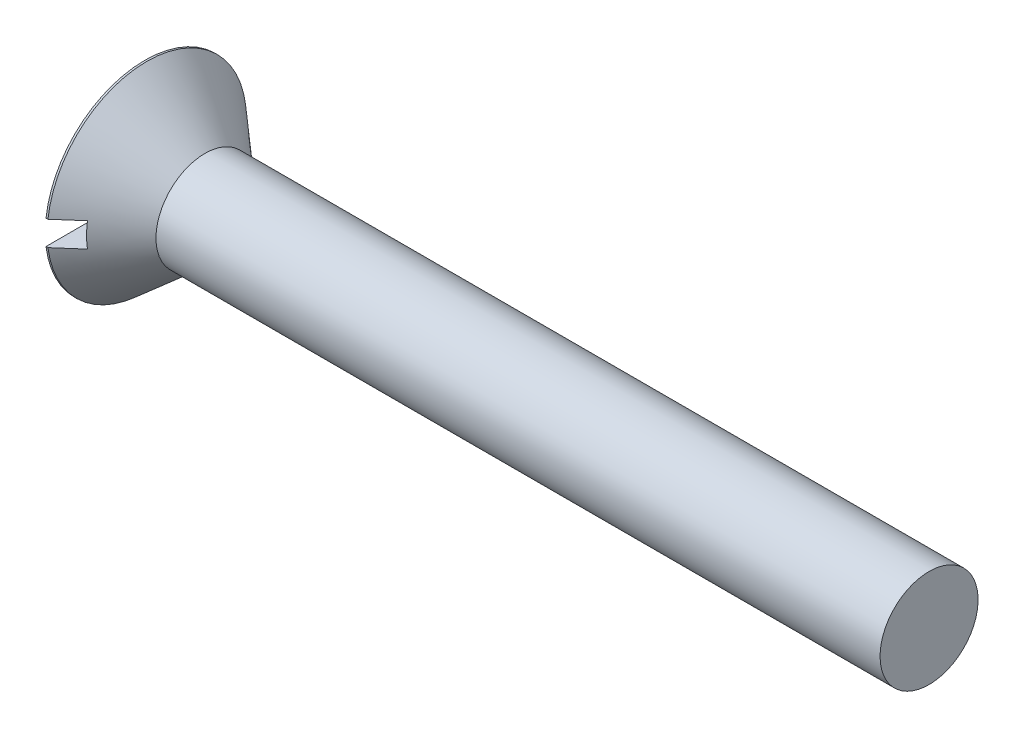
SolidWorks part; units mm, degrees
ref_plane "Plane1" through (0, 0, 0) normal (0, 0, 1) x (1, 0, 0)
ref_plane "Plane2" through (0, 0, 0) normal (0, 1, 0) x (1, 0, 0)
ref_plane "Plane3" through (0, 0, 0) normal (1, 0, 0) x (0, 0, -1)
sketch "BodySke" plane through (0, 0, 0) normal (0, 0, 1) x (1, 0, 0)
  line L0 (0, 0) -> (0, 9.6774)
  line L1 (0, 9.6774) -> (0.1881, 9.6774)
  line L2 (5.842, 4.7625) -> (76.2, 4.7625)
  line L3 (76.2, 4.7625) -> (76.2, 0)
  line L4 (76.2, 0) -> (0, 0)
  line L5 (-6.35, 0) -> (82.55, 0) construction
  line L6 (5.842, -4.7625) -> (76.2, -4.7625) construction
  line L7 (0.1881, -9.6774) -> (5.842, -4.7625) construction
  line L8 (0.1881, 9.6774) -> (5.842, 4.7625)
  line L9 (0, -9.6774) -> (0.1881, -9.6774) construction
  line L10 (7.4295, 6.35) -> (7.4295, -3.175) construction
  line L11 (44.45, 6.35) -> (44.45, -3.175) construction
  dimension "Diameter" = 9.525
  dimension "Length" = 76.2
  dimension "Head_ht" = 5.842
  dimension "Head_dia" = 19.3548
  dimension "Head_ang" = 82
  dimension "D6" = 0.1881
  dimension "Advance" = 1.5875
  dimension "Thread_nom" = 31.75
revolve "Base-Revolve" add sketch "BodySke" angle 360 about L5
sketch "Sketch6" plane through (0, 0, 0) normal (-1, 0, 0) x (0, 0, 1)
  line L0 (-9.6774, -1.1938) -> (9.6774, -1.1938)
  line L1 (-9.6774, -1.1938) -> (-9.6774, 1.1938)
  line L2 (9.6774, 1.1938) -> (-9.6774, 1.1938)
  line L3 (9.6774, 1.1938) -> (9.6774, -1.1938)
  dimension "D1" = 1.1938
  dimension "Slot_width" = 2.3876
  dimension "D2" = 19.3548
  dimension "D3" = 9.6774
extrude "Slot" cut sketch "Sketch6" against normal blind 2.2352
sketch "ThdSchSke" plane through (0, 0, 0) normal (0, 0, 1) x (1, 0, 0)
  line L0 (44.45, -3.9624) -> (43.8898, -4.7625)
  line L1 (44.45, -3.9624) -> (45.0103, -4.7625)
  line L2 (45.0103, -4.7625) -> (45.0103, -5.9531)
  line L3 (-3.175, 0) -> (5.1513, 0) construction
  line L5 (45.0103, -5.9531) -> (43.8898, -5.9531)
  line L6 (43.8898, -5.9531) -> (43.8898, -4.7625)
  line L7 (0, 9.6774) -> (0, 1.1938) construction
  dimension "Thread_minor" = 7.9248
  dimension "Diameter" = 9.525
  dimension "Start" = 44.45
  dimension "SideAngle" = 55
  dimension "VeeAngle" = 70
  dimension "Overcut" = 11.9063
revolve "ThreadSchematic" [suppressed] cut sketch "ThdSchSke" angle 360 about L3
pattern_linear "ThdSchPat" [suppressed]
equation "\"D1@Sketch6\" = \"Slot_width@Sketch6\" / 2"
equation "\"D2@Sketch6\" = \"Head_dia@BodySke\""
equation "\"D3@Sketch6\" = \"D2@Sketch6\" / 2"
equation "\"Thread_length@ThreadCosmetic\" = ((sgn( (\"Length@BodySke\" - \"Advance@BodySke\" - \"Head_ht@BodySke\" ) - \"Thread_nom@BodySke\" )-1)*( (\"Length@BodySke\" - \"Advance@BodySke\" - \"Head_ht@BodySke\" ) - \"Thread_"
equation "\"Thread_minor@ThdSchSke\" = \"Thread_minor@ThreadCosmetic\""
equation "\"Diameter@ThdSchSke\" = \"Diameter@BodySke\""
equation "\"Overcut@ThdSchSke\" = \"Diameter@BodySke\" * 1.25"
equation "\"Start@ThdSchSke\" = 0.000001 + \"Length@BodySke\" - \"Thread_length@ThreadCosmetic\"  '---Countersunk---"
equation "\"Num_threads@ThdSchPat\" = int( \"Thread_length@ThreadCosmetic\" / \"Advance@BodySke\" + 0.999 )  + 1"
equation "\"Advance@ThdSchPat\" = \"Thread_length@ThreadCosmetic\" /  (\"Num_threads@ThdSchPat\" - 1) 'relax it"
